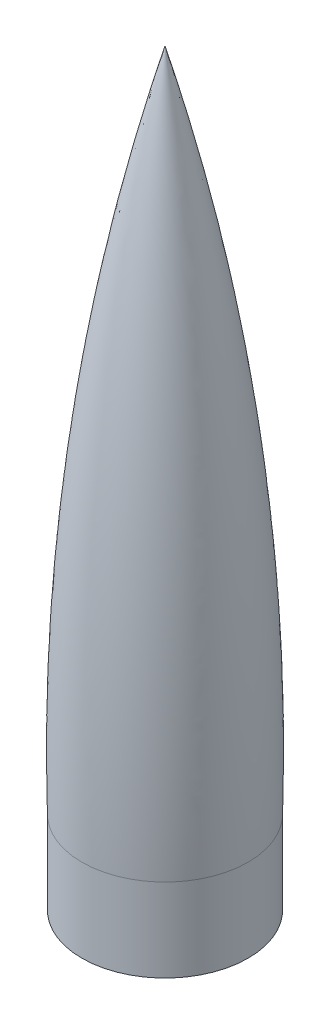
SolidWorks part; units mm, degrees
ref_plane "Front Plane" through (0, 0, 0) normal (0, 0, 1) x (1, 0, 0)
ref_plane "Top Plane" through (0, 0, 0) normal (0, 1, 0) x (1, 0, 0)
ref_plane "Right Plane" through (0, 0, 0) normal (1, 0, 0) x (0, 0, -1)
sketch "Sketch2" plane through (0, 0, 0) normal (0, 0, 1) x (1, 0, 0)
  line L0 (0, 0) -> (0, 304.8) construction
  line L1 (0, 0) -> (38.1, 0) construction
  line L2 (0, 304.8) -> (0, 0)
  line L3 (0, 0) -> (38.1, 0)
  arc A0 (0, 304.8) -> (38.1, 0) centre (-997.2381, 25.364) cw
  dimension "D1" = 304.8
  dimension "D2" = 38.1
revolve "Revolve3" add sketch "Sketch2" angle 360 about L2
shell "Shell1" thickness 3.175
sketch "Sketch3" plane through (0, 0, 0) normal (0, -1, 0) x (1, 0, 0)
  circle A0 centre (0, 0) radius 34.924
  circle A1 centre (0, 0) radius 38.1
extrude "Boss-Extrude1" add sketch "Sketch3" along normal blind 38.1
